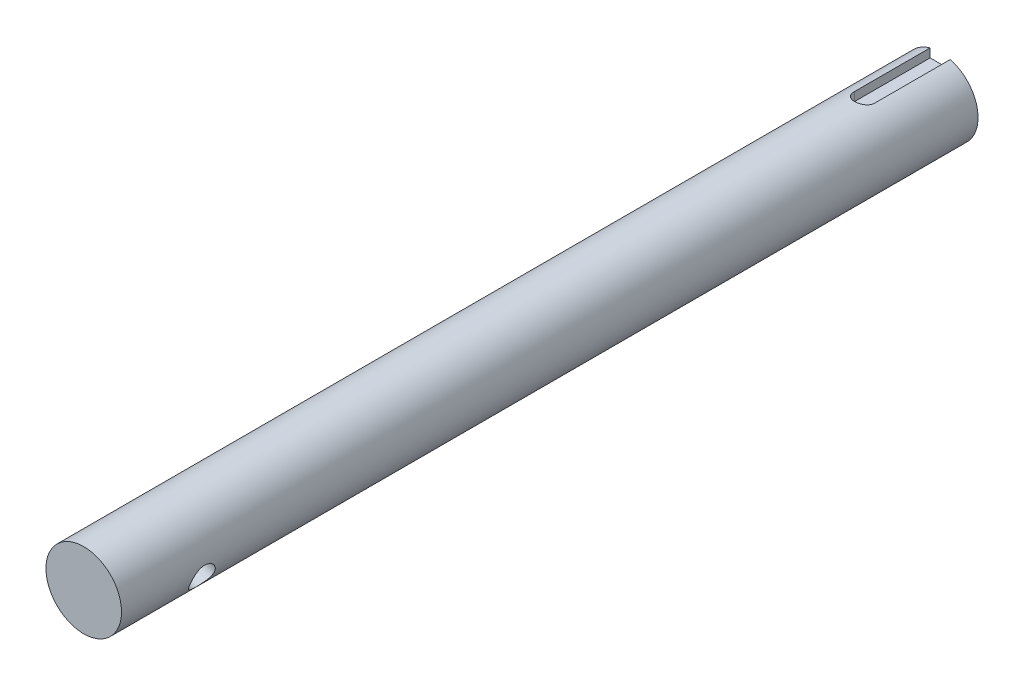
SolidWorks part; units mm, degrees
ref_plane "Plan1" through (0, 0, 0) normal (0, 0, 1) x (1, 0, 0)
ref_plane "Plan2" through (0, 0, 0) normal (0, 1, 0) x (1, 0, 0)
ref_plane "Plan3" through (0, 0, 0) normal (1, 0, 0) x (0, 0, -1)
sketch "Esquisse1" plane through (0, 0, 0) normal (0, 0, 1) x (1, 0, 0)
  circle A0 centre (0, 0) radius 15
  dimension "D1" = 30
extrude "Base-Extrusion" add sketch "Esquisse1" along normal blind 340
sketch "Esquisse2" plane through (0, 0, 0) normal (1, 0, 0) x (0, 0, -1)
  line L0 (-30, 11) -> (0, 11)
  line L1 (0, -15) -> (0, 15) construction
  line L2 (0, 11) -> (0, 15)
  line L3 (0, 15) -> (-340, 15) construction
  line L4 (0, 15) -> (-30, 15)
  line L5 (-30, 15) -> (-30, 11)
  dimension "D2" = 30
  dimension "D1" = 11
extrude "Enlèv. mat.-Extru.1" cut sketch "Esquisse2" against normal mid plane 8
sketch "Esquisse5" plane through (0, 11, 0) normal (0, 1, 0) x (-1, 0, 0)
  line L0 (4, 0) -> (4, 30) construction
  line L1 (-4, 0) -> (-4, 30) construction
  line L2 (-4, 30) -> (4, 30) construction
  circle A0 centre (0, 30) radius 4
extrude "Enlèv. mat.-Extru.2" cut sketch "Esquisse5" along normal through all
hole_wizard "M8x1.25 Trou taraudé1" positions "Esquisse4" profile "Esquisse3" tap size "M8x1.25" standard "Ansi Métrique"
sketch "Esquisse4" plane through (0, 0, 0) normal (0, 0, -1) x (-1, 0, 0)
  point P0 (0, 0)
sketch "Esquisse3" plane through (0, 0, 0) normal (1, 0, 0) x (0, 1, 0)
  line L0 (0, 0) -> (0, 28.2929)
  line L1 (0, 28.2929) -> (3.4, 26.25)
  line L2 (3.4, 26.25) -> (3.4, 0)
  line L5 (3.4, 0) -> (0, 0)
  line L10 (0, 28.2929) -> (-3.4, 26.25) construction
  line L11 (0, -6.35) -> (0, 107.95) construction
  dimension "Diamètre du perçage" = 6.8
  dimension "Profondeur du perçage" = 26.25
  dimension "Angle de pointe" = 118
ref_plane "Plan4" through (0, 0, 0) normal (0.9336, -0.3584, 0) x (0, 0, -1)
sketch "Esquisse6" plane through (0, 0, 0) normal (0.9336, -0.3584, 0) x (0, 0, -1)
  line L0 (-340, 0) -> (0, 0) construction
  line L1 (-340, 15) -> (-340, -15) construction
  circle A0 centre (-307, 0) radius 5
  dimension "D2" = 10
  dimension "D1" = 33
extrude "Enlèv. mat.-Extru.3" cut sketch "Esquisse6" against normal through all and the other way through all
ref_plane "Plan5" through (0, 0, 234) normal (0, 0, 1) x (1, 0, 0)
ref_plane "Plan6" through (0, 0, 140) normal (0, 0, 1) x (1, 0, 0)
